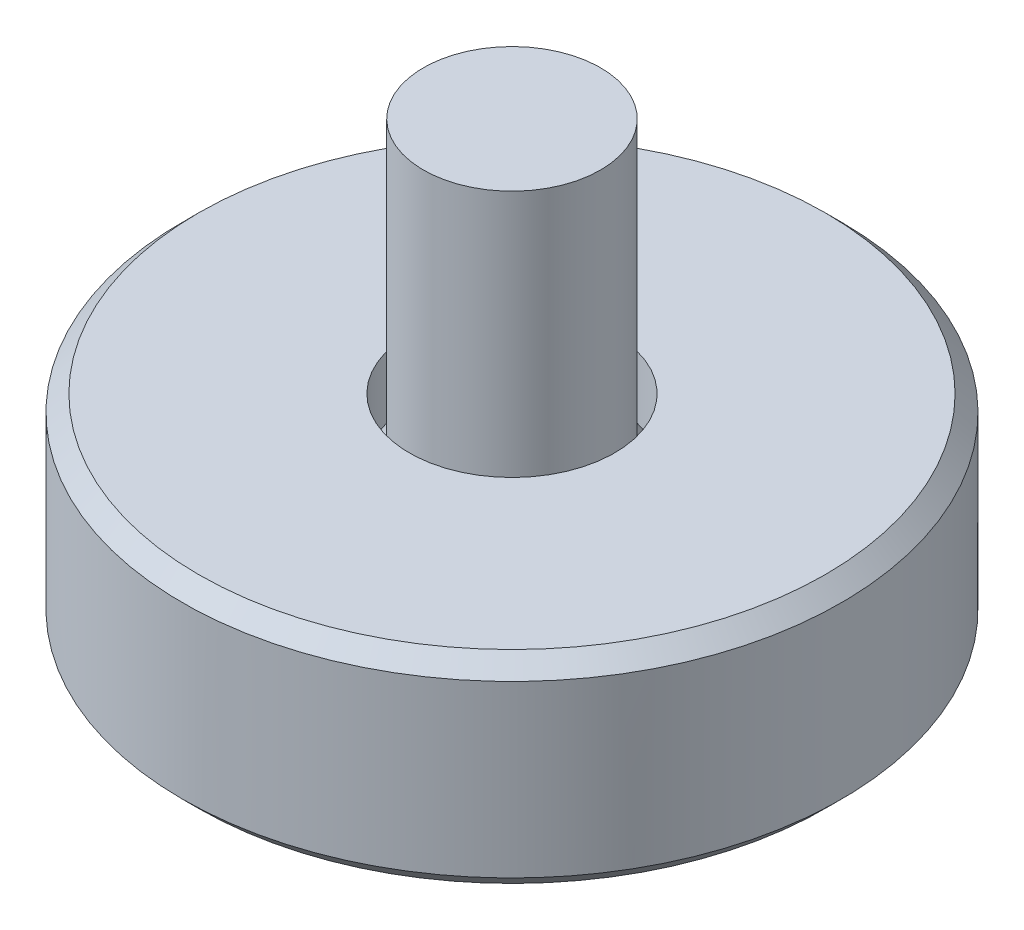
SolidWorks part; units mm, degrees
other "<FHCS8L.37>-<HEX>"
ref_plane "Front Plane" through (0, 0, 0) normal (0, 0, 1) x (1, 0, 0)
ref_plane "Top Plane" through (0, 0, 0) normal (0, 1, 0) x (1, 0, 0)
ref_plane "Right Plane" through (0, 0, 0) normal (1, 0, 0) x (0, 0, -1)
sketch "Sketch1" plane through (0, 0, 0) normal (0, 1, 0) x (1, 0, 0)
  circle A0 centre (0, 0) radius 7.747
  dimension "D1" = 15.494
extrude "Extrude1" add sketch "Sketch1" along normal blind 4.7625
chamfer "Chamfer1" distance 0.381 angle 45 2 edges at (0, 0, 7.747) (0, 4.7625, 7.747)
sketch "Sketch2" plane through (0, 0, 0) normal (0, 0, 1) x (1, 0, 0)
  line L0 (0, -2.05) -> (0, 7.8227) construction
  line L1 (0, 0) -> (5.2834, 0)
  line L2 (-7.366, 0) -> (7.366, 0) construction
  line L3 (5.2834, 0) -> (2.413, 3.302)
  line L4 (2.413, 3.302) -> (2.413, 4.7625)
  line L5 (7.366, 4.7625) -> (-7.366, 4.7625) construction
  line L6 (2.413, 4.7625) -> (0, 4.7625)
  line L7 (0, 4.7625) -> (0, 0)
  dimension "D1" = 4.826
  dimension "D2" = 3.302
  dimension "D3" = 41
revolve "Cut-Revolve1" cut sketch "Sketch2" angle 360 about L0
inserted part "FHCS8L.37"
move or copy body "Body-Move/Copy2" placed by mates yes
